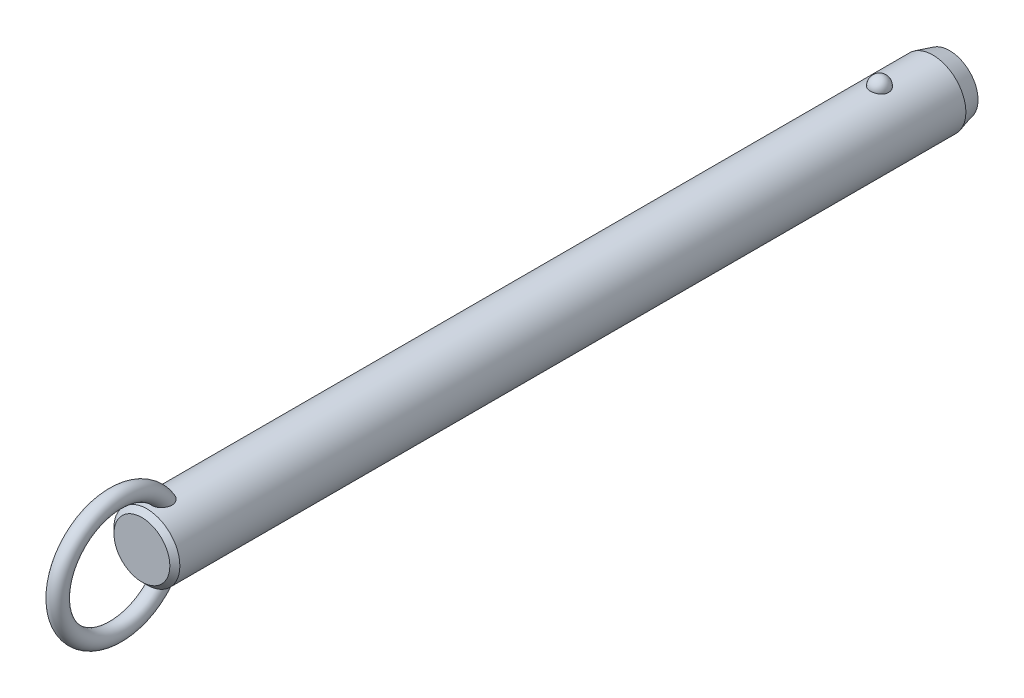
SolidWorks part; units mm, degrees
ref_plane "Front Plane" through (0, 0, 0) normal (0, 0, 1) x (1, 0, 0)
ref_plane "Top Plane" through (0, 0, 0) normal (0, 1, 0) x (1, 0, 0)
ref_plane "Right Plane" through (0, 0, 0) normal (1, 0, 0) x (0, 0, -1)
sketch "Sketch2" plane through (0, 0, 0) normal (0, 0, 1) x (1, 0, 0)
  circle A0 centre (0, 0) radius 7.9
  point P3 (0, 7.9)
  dimension "D1" = 15.8
extrude "Boss-Extrude1" add sketch "Sketch2" along normal blind 165.1
sketch "Sketch3" plane through (0, 0, 0) normal (0, 0, -1) x (-1, 0, 0)
  circle A0 centre (0, 0) radius 7.9
  dimension "D1" = 15.8
extrude "Boss-Extrude2" add sketch "Sketch3" along normal blind 19
chamfer "Chamfer1" distance 4 angle 15 1 edges at (-7.9, 0, -19)
sketch "Sketch12" plane through (0, 0, 0) normal (1, 0, 0) x (0, 0, -1)
  line L0 (-165.1, 7.9) -> (-165.1, -7.9) construction
  point P0 (-165.1, 0)
sketch "Sketch13" plane through (0, 0, 0) normal (1, 0, 0) x (0, 0, -1)
  circle A0 centre (-180.95, 0) radius 15.85
  point P2 (-165.1, 0)
  dimension "D1" = 31.7
sketch "Sketch14" plane through (0, 0, 0) normal (0, 1, 0) x (1, 0, 0)
  circle A0 centre (0, -167.1) radius 2
  point P2 (0, -165.1)
  dimension "D1" = 4
sweep "Sweep1" add profiles "Sketch14" path "Sketch13"
sketch "Sketch15" plane through (0, 0, 165.1) normal (0, 0, 1) x (1, 0, 0)
  circle A0 centre (0, 0) radius 7.9
  dimension "D1" = 15.8
extrude "Boss-Extrude3" add sketch "Sketch15" along normal blind 9.52
chamfer "Chamfer2" distance 1.2 angle 45 1 edges at (7.9, 0, 174.62)
sketch "Sketch18" plane through (0, 0, 0) normal (1, 0, 0) x (0, 0, -1)
  line L0 (15, 7.9) -> (-167.2091, 7.9) construction
  line L1 (2.2, 10.1) -> (2.2, 5.7)
  line L2 (-167.2091, -7.9) -> (15, -7.9) construction
  arc A0 (2.2, 10.1) -> (2.2, 5.7) centre (2.2, 7.9) ccw
  point P4 (0, 7.9)
  dimension "D1" = 18
revolve "Revolve1" add sketch "Sketch18" angle 360 about L1
